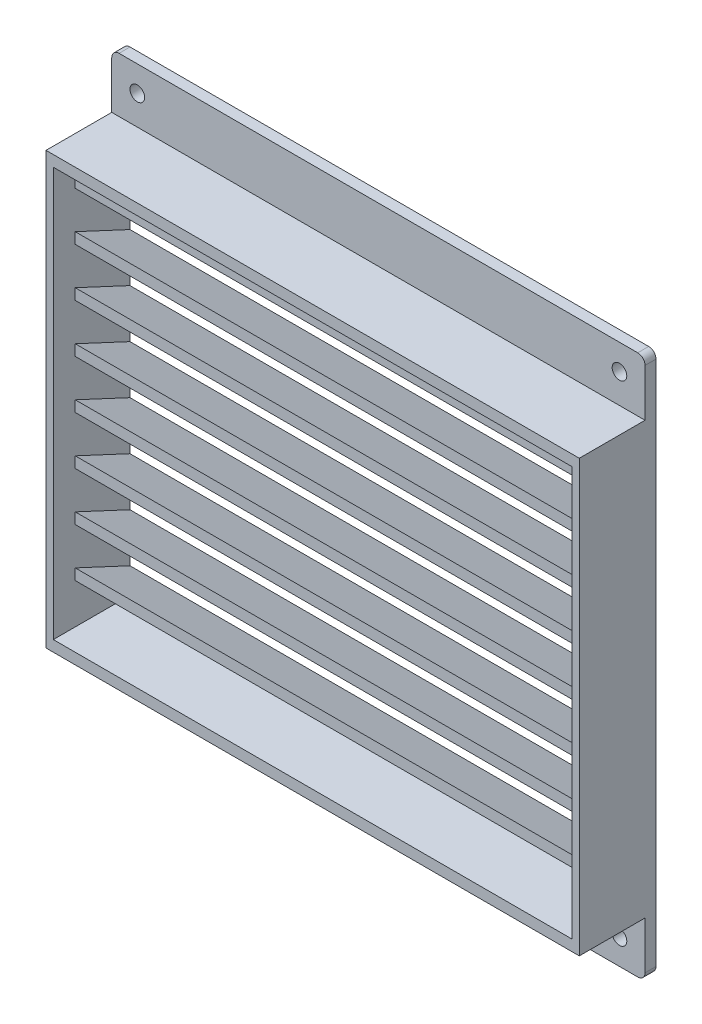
SolidWorks part; units mm, degrees
ref_plane "Спереди" through (0, 0, 0) normal (0, 0, 1) x (1, 0, 0)
ref_plane "Сверху" through (0, 0, 0) normal (0, 1, 0) x (1, 0, 0)
ref_plane "Справа" through (0, 0, 0) normal (1, 0, 0) x (0, 0, -1)
sketch "Эскиз1" plane through (0, 0, 0) normal (1, 0, 0) x (0, 0, -1)
  line L0 (0, 0) -> (0, 118) construction
  line L1 (0, 0) -> (-21, 0)
  line L2 (0, 0) -> (0, 3)
  line L3 (0, 3) -> (-21, 3)
  line L4 (-21, 0) -> (-21, 3)
  line L5 (0, 115) -> (-21, 115)
  line L6 (0, 115) -> (0, 118)
  line L7 (0, 118) -> (-21, 118)
  line L8 (-21, 115) -> (-21, 118)
  line L9 (0, 7) -> (-15, 13.9946)
  line L10 (-15, 13.9946) -> (-15, 16.9946)
  line L11 (-15, 16.9946) -> (0, 10)
  line L12 (0, 10) -> (0, 7)
  line L13 (-15, 27.2803) -> (-15, 30.2803)
  line L14 (-15, 30.2803) -> (0, 23.2857)
  line L15 (0, 23.2857) -> (0, 20.2857)
  line L16 (0, 20.2857) -> (-15, 27.2803)
  line L17 (-15, 40.566) -> (-15, 43.566)
  line L18 (-15, 43.566) -> (0, 36.5714)
  line L19 (0, 36.5714) -> (0, 33.5714)
  line L20 (0, 33.5714) -> (-15, 40.566)
  line L21 (-15, 53.8518) -> (-15, 56.8518)
  line L22 (-15, 56.8518) -> (0, 49.8571)
  line L23 (0, 49.8571) -> (0, 46.8571)
  line L24 (0, 46.8571) -> (-15, 53.8518)
  line L25 (-15, 67.1375) -> (-15, 70.1375)
  line L26 (-15, 70.1375) -> (0, 63.1429)
  line L27 (0, 63.1429) -> (0, 60.1429)
  line L28 (0, 60.1429) -> (-15, 67.1375)
  line L29 (-15, 80.4232) -> (-15, 83.4232)
  line L30 (-15, 83.4232) -> (0, 76.4286)
  line L31 (0, 76.4286) -> (0, 73.4286)
  line L32 (0, 73.4286) -> (-15, 80.4232)
  line L49 (-15, 93.7089) -> (-15, 96.7089)
  line L50 (-15, 96.7089) -> (0, 89.7143)
  line L51 (0, 89.7143) -> (0, 86.7143)
  line L52 (0, 86.7143) -> (-15, 93.7089)
  line L53 (-15, 106.9946) -> (-15, 109.9946)
  line L54 (-15, 109.9946) -> (0, 103)
  line L55 (0, 103) -> (0, 100)
  line L56 (0, 100) -> (-15, 106.9946)
  dimension "D2" = 118
  dimension "D3" = 3
  dimension "D4" = 21
  dimension "D5" = 4
  dimension "D6" = 12
  dimension "D7" = 15
  dimension "D8" = 65
  dimension "D9" = 3.2911
  dimension "D1" = 8
extrude "Бобышка-Вытянуть1" add sketch "Эскиз1" along normal blind 146
sketch "Эскиз2" plane through (0, 0, 0) normal (0, 0, -1) x (-1, 0, 0)
  line L0 (-146, 0) -> (0, 0) construction
  line L1 (-146, 118) -> (-144, 118)
  line L2 (-146, 118) -> (-146, 0)
  line L3 (-146, 0) -> (-144, 0)
  line L4 (-144, 118) -> (-144, 0)
  line L6 (0, 118) -> (-2, 118)
  line L7 (0, 118) -> (0, 0)
  line L8 (0, 0) -> (-2, 0)
  line L9 (-2, 118) -> (-2, 0)
  dimension "D1" = 2
extrude "Бобышка-Вытянуть2" add sketch "Эскиз2" against normal up to surface (21 mm away)
sketch "Эскиз3" plane through (0, 0, 0) normal (0, 0, -1) x (-1, 0, 0)
  line L0 (0, 59) -> (-146, 59) construction
  line L1 (-146, 0) -> (0, 0)
  line L2 (-146, 0) -> (-146, -15)
  line L3 (-146, -15) -> (0, -15)
  line L4 (0, 0) -> (0, -15)
  line L5 (0, 0) -> (0, 118) construction
  line L6 (-146, 0) -> (-146, 118) construction
  line L7 (-73, -15) -> (-73, 0) construction
  line L8 (0, 118) -> (0, 133)
  line L9 (-146, 133) -> (0, 133)
  line L10 (-146, 118) -> (-146, 133)
  line L11 (-146, 118) -> (0, 118)
  circle A2 centre (-139, -8) radius 2
  circle A3 centre (-7, -8) radius 2
  circle A4 centre (-7, 126) radius 2
  circle A5 centre (-139, 126) radius 2
extrude "Бобышка-Вытянуть3" add sketch "Эскиз3" against normal blind 3
fillet "Скругление1" radius 2 4 edges at (0, 133, 1.5) (0, -15, 1.5) (146, -15, 1.5) (146, 133, 1.5)
equation "\"D4@Эскиз3\"=\"D3@Эскиз3\""
